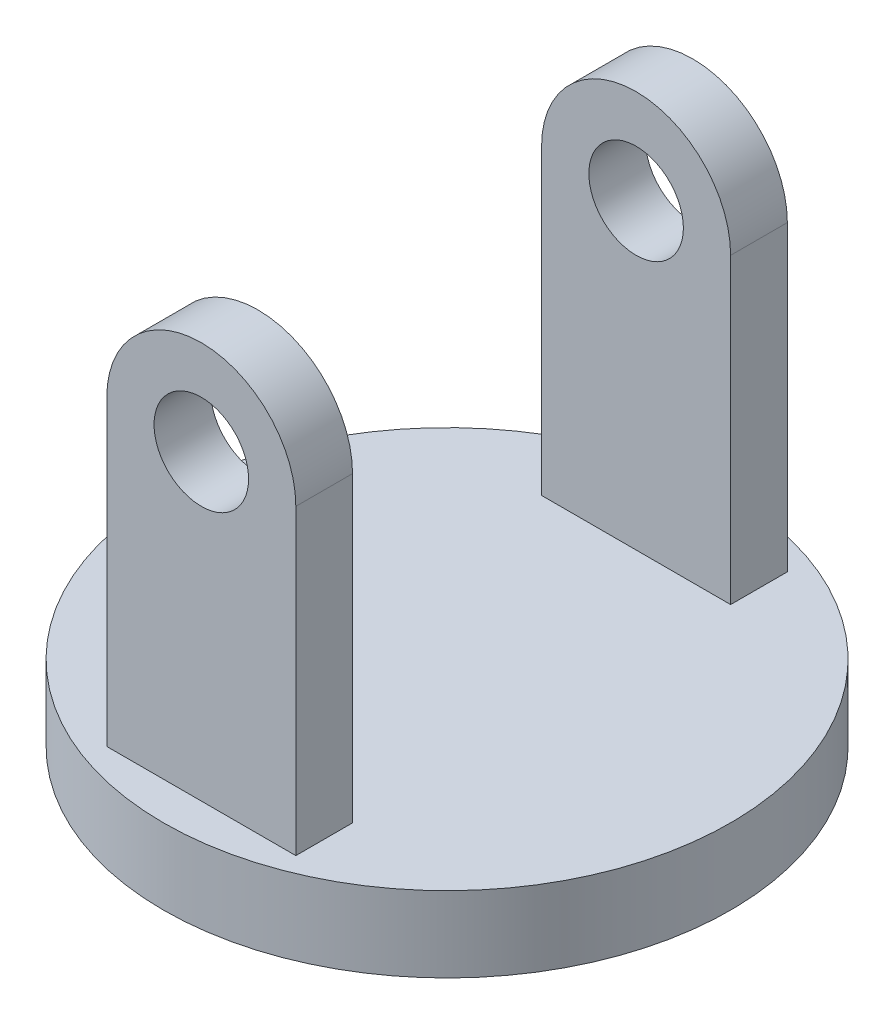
SolidWorks part; units mm, degrees
ref_plane "Front Plane" through (0, 0, 0) normal (0, 0, 1) x (1, 0, 0)
ref_plane "Top Plane" through (0, 0, 0) normal (0, 1, 0) x (1, 0, 0)
ref_plane "Right Plane" through (0, 0, 0) normal (1, 0, 0) x (0, 0, -1)
sketch "Sketch1" plane through (0, 0, 0) normal (0, 1, 0) x (1, 0, 0)
  circle A0 centre (0, 0) radius 75
  dimension "D1" = 150
extrude "Boss-Extrude1" add sketch "Sketch1" along normal blind 20
ref_plane "Plane1" through (0, 0, 50) normal (0, 0, 1) x (1, 0, 0)
sketch "Sketch2" plane through (0, 0, 50) normal (0, 0, 1) x (1, 0, 0)
  line L0 (75, 20) -> (-75, 20) construction
  line L1 (25, 20) -> (-25, 20)
  line L2 (25, 20) -> (25, 100)
  line L4 (-25, 20) -> (-25, 100)
  arc A0 (-25, 100) -> (25, 100) centre (0, 100) cw
  circle A1 centre (0, 100) radius 12.5
  point P8 (0, 0)
  point P10 (0, 20)
  dimension "D1" = 25
  dimension "D2" = 25
  dimension "D3" = 100
extrude "Boss-Extrude2" add sketch "Sketch2" along normal blind 15
mirror "Mirror1" about plane through (0, 0, 0) normal (0, 0, 1) of "Boss-Extrude2"
